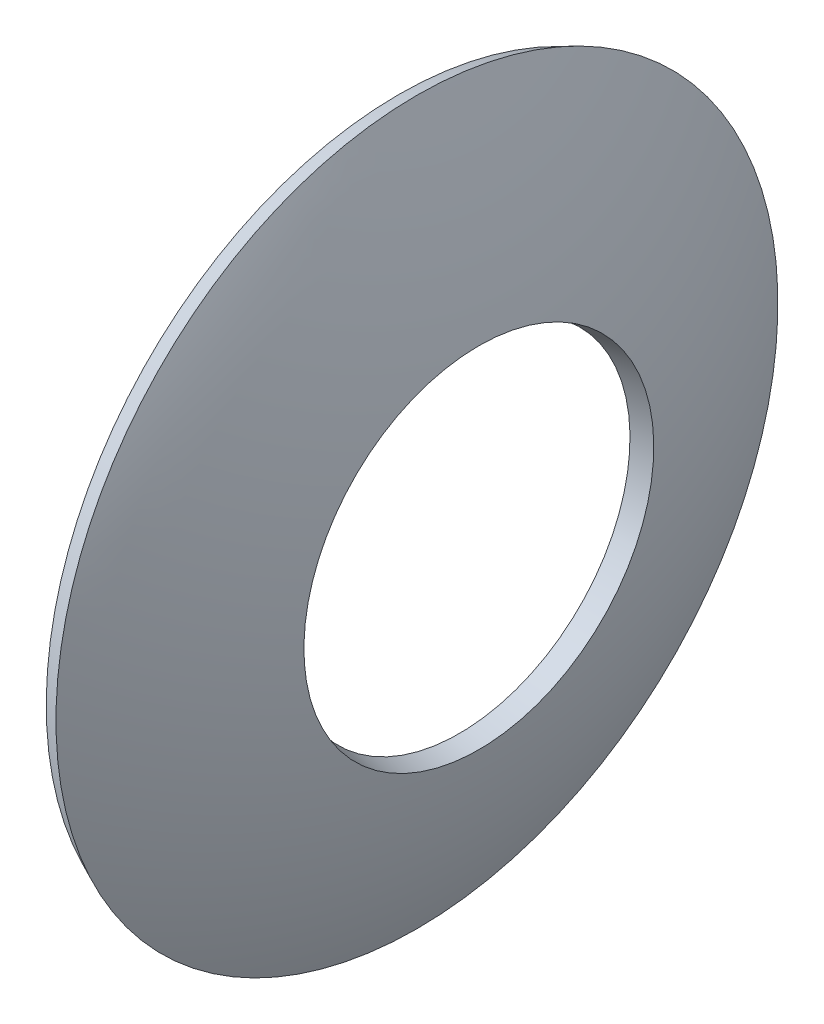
SolidWorks part; units mm, degrees
ref_plane "Plan de face" through (0, 0, 0) normal (0, 0, 1) x (1, 0, 0)
ref_plane "Plan de dessus" through (0, 0, 0) normal (0, 1, 0) x (1, 0, 0)
ref_plane "Plan de droite" through (0, 0, 0) normal (1, 0, 0) x (0, 0, -1)
sketch "Esquisse1" plane through (0, 0, 0) normal (0, 0, 1) x (1, 0, 0)
  line L0 (0, 0) -> (62.5556, 0) construction
  line L1 (0, 0) -> (37.6118, 17.5387) construction
  arc A0 (40.6202, 8.5) -> (37.6118, 17.5387) centre (0, 0) ccw
  dimension "D1" = 83
  dimension "D2" = 25
  dimension "D3" = 17
revolve "Révol.-Mince1" add sketch "Esquisse1" angle 360 about L0
